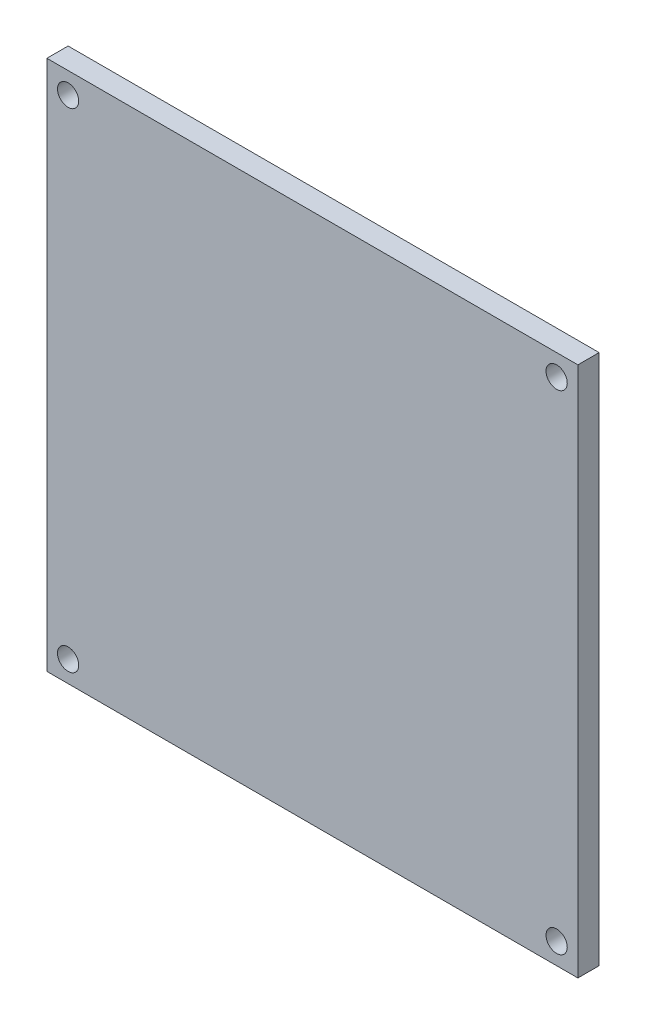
SolidWorks part; units mm, degrees
ref_plane "前基準面" through (0, 0, 0) normal (0, 0, 1) x (1, 0, 0)
ref_plane "上基準面" through (0, 0, 0) normal (0, 1, 0) x (1, 0, 0)
ref_plane "右基準面" through (0, 0, 0) normal (1, 0, 0) x (0, 0, -1)
sketch "草圖1" plane through (0, 0, 0) normal (0, 0, 1) x (1, 0, 0)
  line L1 (0, 0) -> (250, 0)
  line L2 (0, 0) -> (0, -250)
  line L3 (0, -250) -> (250, -250)
  line L4 (250, 0) -> (250, -250)
  dimension "D1" = 250
  dimension "D2" = 250
extrude "填料-伸長1" add sketch "草圖1" along normal blind 10
hole_wizard "M10x1.0 螺紋孔1" positions "草圖3" profile "草圖2" tap size "M10x1.0" standard "ISO"
sketch "草圖3" plane through (0, 0, 10) normal (0, 0, 1) x (1, 0, 0)
  line L0 (0, 0) -> (0, -250) construction
  line L1 (0, -250) -> (250, -250) construction
  line L2 (250, 0) -> (0, 0) construction
  point P0 (10, -10)
  point P1 (240, -10)
  point P3 (10, -240)
  point P5 (240, -240)
  dimension "D1" = 230
  dimension "D2" = 10
  dimension "D3" = 230
  dimension "D4" = 10
  dimension "D5" = 230
  dimension "D6" = 10
  dimension "D7" = 10
  dimension "D8" = 10
sketch "草圖2" plane through (10, -10, 10) normal (1, 0, 0) x (0, -1, 0)
  line L0 (0, 0) -> (0, 27.7039)
  line L1 (0, 27.7039) -> (4.5, 25)
  line L2 (4.5, 25) -> (4.5, 20)
  line L3 (4.5, 20) -> (5, 20)
  line L4 (5, 20) -> (5, 0)
  line L5 (5, 0) -> (0, 0)
  line L10 (0, 27.7039) -> (-4.5, 25) construction
  line L11 (0, -6.35) -> (0, 107.95) construction
  dimension "螺孔鑽直徑" = 9
  dimension "螺孔鑽深度" = 25
  dimension "螺紋主直徑" = 10
  dimension "螺紋深度" = 20
  dimension "導頭角度" = 118
